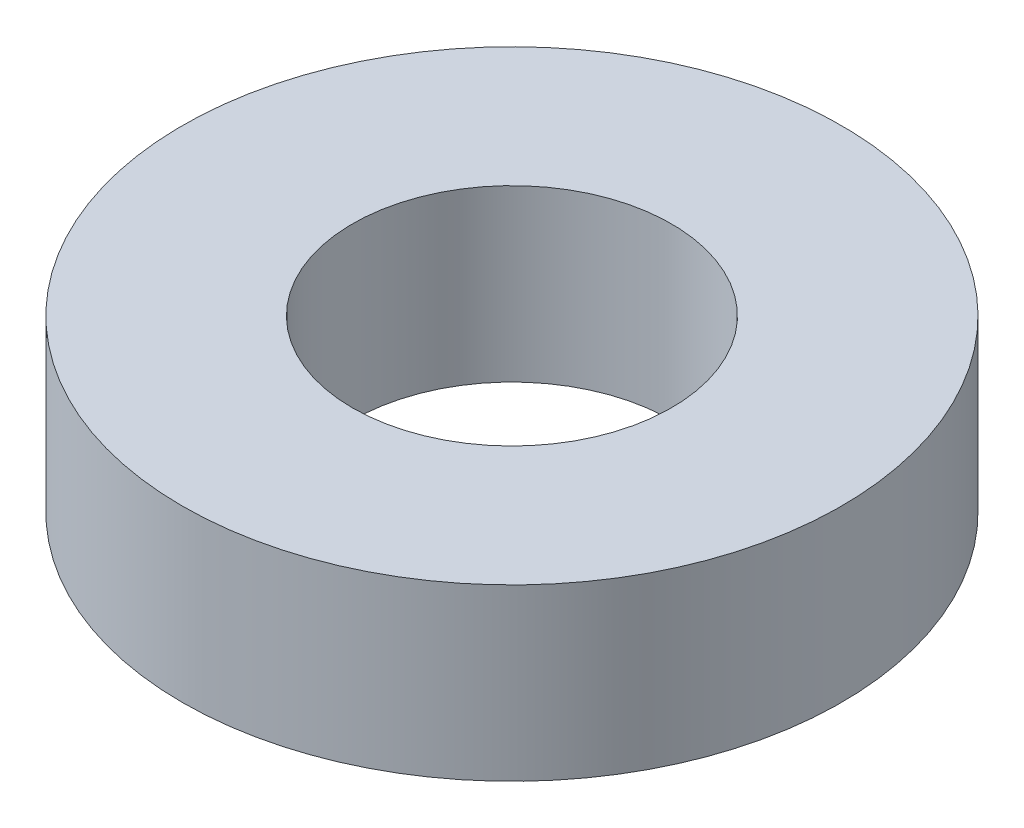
SolidWorks part; units mm, degrees
ref_plane "前视基准面" through (0, 0, 0) normal (0, 0, 1) x (1, 0, 0)
ref_plane "上视基准面" through (0, 0, 0) normal (0, 1, 0) x (1, 0, 0)
ref_plane "右视基准面" through (0, 0, 0) normal (1, 0, 0) x (0, 0, -1)
sketch "草图1" plane through (0, 0, 0) normal (0, 1, 0) x (1, 0, 0)
  circle A0 centre (0, 0) radius 15
  circle A1 centre (0, 0) radius 31
  dimension "D1" = 62
  dimension "D2" = 30
extrude "凸台-拉伸1" add sketch "草图1" along normal blind 16
